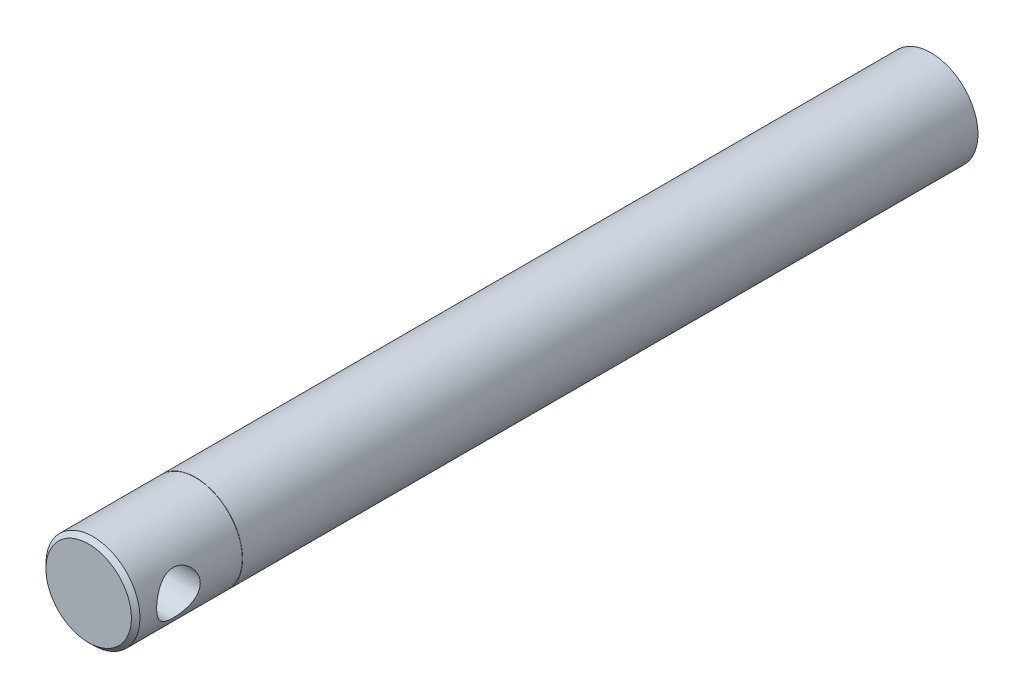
SolidWorks part; units mm, degrees
ref_plane "Plan de face" through (0, 0, 0) normal (0, 0, 1) x (1, 0, 0)
ref_plane "Plan de dessus" through (0, 0, 0) normal (0, 1, 0) x (1, 0, 0)
ref_plane "Plan de droite" through (0, 0, 0) normal (1, 0, 0) x (0, 0, -1)
sketch "Esquisse1" plane through (0, 0, 0) normal (0, 0, 1) x (1, 0, 0)
  circle A0 centre (0, 0) radius 11
  circle A1 centre (0, 0) radius 10
  dimension "D1" = 20
  dimension "D2" = 22
extrude "Extrusion1" add sketch "Esquisse1" along normal blind 172
sketch "Esquisse2" plane through (0, 0, 172) normal (0, 0, 1) x (1, 0, 0)
  circle A0 centre (0, 0) radius 10.95
  dimension "D1" = 21.9
extrude "Extrusion2" add sketch "Esquisse2" along normal blind 0.1
sketch "Esquisse3" plane through (0, 0, 172.1) normal (0, 0, 1) x (1, 0, 0)
  circle A0 centre (0, 0) radius 11
  dimension "D1" = 22
extrude "Extrusion3" add sketch "Esquisse3" along normal blind 24.9
sketch "Esquisse5" plane through (0, 0, 0) normal (1, 0, 0) x (0, 0, -1)
  line L0 (-197, 11) -> (-197, -11) construction
  line L1 (-187, 0) -> (-197, 0) construction
  circle A0 centre (-187, 0) radius 5.1
  dimension "D2" = 10.2
  dimension "D1" = 10
extrude "Enlèv. mat.-Extru.2" cut sketch "Esquisse5" against normal through all and the other way through all
chamfer "Chanfrein1" distance 1 angle 45 1 edges at (11, 0, 197)
